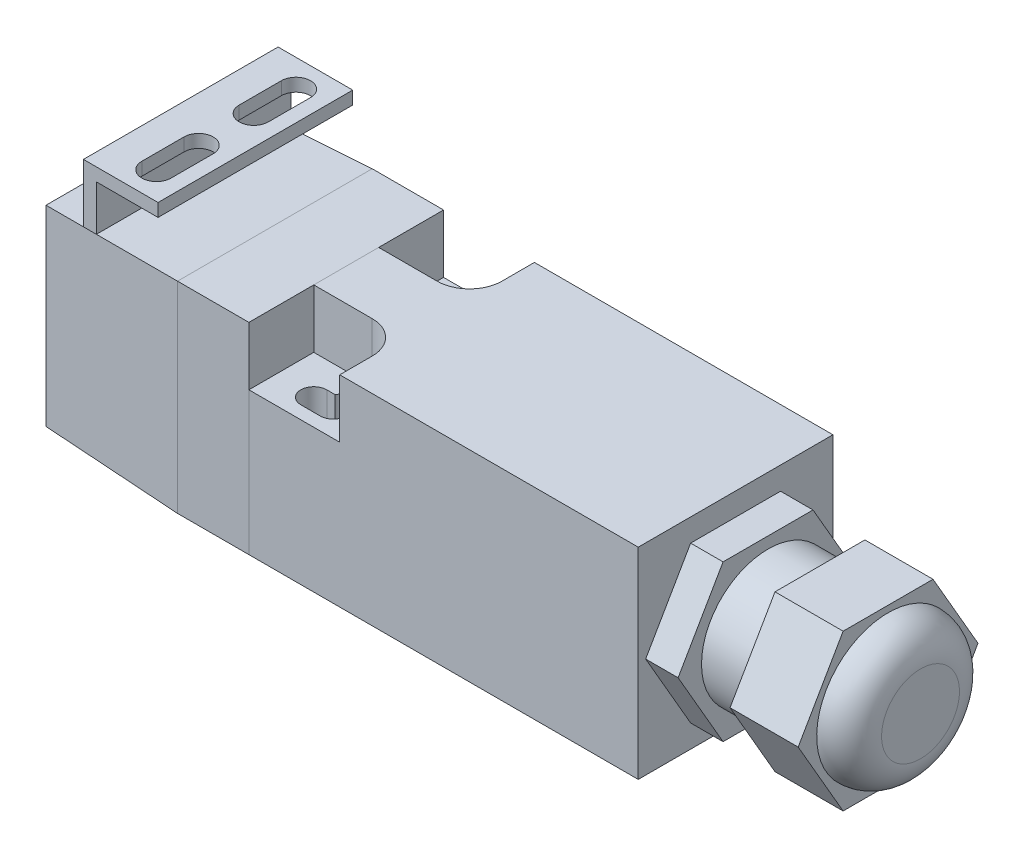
SolidWorks part; units mm, degrees
ref_plane "Plan de face" through (0, 0, 0) normal (0, 0, 1) x (1, 0, 0)
ref_plane "Plan de dessus" through (0, 0, 0) normal (0, 1, 0) x (1, 0, 0)
ref_plane "Plan de droite" through (0, 0, 0) normal (1, 0, 0) x (0, 0, -1)
sketch "Esquisse1" plane through (0, 0, 0) normal (0, 0, 1) x (1, 0, 0)
  line L1 (0, 15.5) -> (60, 15.5)
  line L2 (0, 15.5) -> (0, -15.5)
  line L3 (0, -15.5) -> (60, -15.5)
  line L4 (60, 15.5) -> (60, -15.5)
  dimension "D1" = 31
  dimension "D2" = 60
extrude "Extrusion1" add sketch "Esquisse1" along normal mid plane 30
sketch "Esquisse2" plane through (0, 15.5, 0) normal (0, 1, 0) x (-1, 0, 0)
  line L1 (0, -15) -> (-14, -15)
  line L2 (0, -15) -> (0, -5)
  line L3 (0, -5) -> (-9, -5)
  line L4 (-14, -15) -> (-14, -10)
  line L5 (0, 15) -> (-14, 15)
  line L6 (0, 15) -> (0, 5)
  line L7 (0, 5) -> (-9, 5)
  line L8 (-14, 15) -> (-14, 10)
  arc A0 (-9, -5) -> (-14, -10) centre (-9, -10) ccw
  arc A1 (-9, 5) -> (-14, 10) centre (-9, 10) cw
  point P12 (-14, 5)
  dimension "D4" = 5
  dimension "D1" = 10
  dimension "D2" = 10
  dimension "D3" = 14
extrude "Enlèv. mat.-Extru.1" cut sketch "Esquisse2" against normal blind 9
sketch "Esquisse3" plane through (0, -15.5, 0) normal (0, -1, 0) x (1, 0, 0)
  line L0 (0, 0) -> (31.5871, 0) construction
  line L1 (6, 13) -> (9, 13)
  line L2 (0, 15) -> (0, -15) construction
  line L3 (11, 10) -> (11, 11)
  line L4 (6, 9) -> (7.2679, 9)
  line L9 (6, -9) -> (7.2679, -9)
  line L10 (11, -10) -> (11, -11)
  line L11 (6, -13) -> (9, -13)
  arc A0 (7.2679, 9) -> (11, 10) centre (9, 10) ccw
  arc A1 (6, 13) -> (6, 9) centre (6, 11) ccw
  arc A2 (11, 11) -> (9, 13) centre (9, 11) ccw
  arc A6 (11, -11) -> (9, -13) centre (9, -11) cw
  arc A7 (6, -13) -> (6, -9) centre (6, -11) cw
  arc A8 (7.2679, -9) -> (11, -10) centre (9, -10) cw
  dimension "D1" = 6
  dimension "D2" = 2
  dimension "D7" = 20
  dimension "D3" = 2
  dimension "D4" = 3
  dimension "D5" = 1
  dimension "D6" = 22
extrude "Enlèv. mat.-Extru.2" cut sketch "Esquisse3" against normal through all
sketch "Esquisse4" plane through (0, 0, 0) normal (-1, 0, 0) x (0, 0, 1)
  line L1 (-15, -15.5) -> (15, -15.5)
  line L2 (-15, -15.5) -> (-15, 15.5)
  line L3 (-15, 15.5) -> (15, 15.5)
  line L4 (15, -15.5) -> (15, 15.5)
extrude "Extrusion2" add sketch "Esquisse4" along normal blind 11 separate body
sketch "Esquisse5" plane through (-11, 0, 0) normal (-1, 0, 0) x (0, 0, 1)
  line L1 (-15, 15.5) -> (15, 15.5)
  line L2 (-15, 15.5) -> (-15, -15.5)
  line L3 (-15, -15.5) -> (15, -15.5)
  line L4 (15, 15.5) -> (15, -15.5)
extrude "Extrusion3" add sketch "Esquisse5" along normal blind 21 draft 2
sketch "Esquisse6" plane through (0, 15.5, 0) normal (0, 1, 0) x (-1, 0, 0)
  line L0 (32, 14.2667) -> (32, -14.2667) construction
  line L1 (22, -7.5) -> (27, -7.5)
  line L2 (22, -7.5) -> (22, 7.5)
  line L3 (22, 7.5) -> (27, 7.5)
  line L4 (27, -7.5) -> (27, 7.5)
  dimension "D1" = 5
  dimension "D2" = 15
  dimension "D3" = 5
  dimension "D4" = 7.5
extrude "Enlèv. mat.-Extru.3" cut sketch "Esquisse6" against normal blind 5
sketch "Esquisse7" plane through (0, 15.5, 0) normal (0, 1, 0) x (-1, 0, 0)
  line L0 (32, 14.2667) -> (32, -14.2667) construction
  line L1 (25.5, -6.5) -> (23.5, -6.5)
  line L2 (25.5, -6.5) -> (25.5, 6.5)
  line L3 (25.5, 6.5) -> (23.5, 6.5)
  line L4 (23.5, -6.5) -> (23.5, 6.5)
  dimension "D1" = 2
  dimension "D2" = 13
  dimension "D3" = 6.5
  dimension "D4" = 6.5
extrude "Extrusion4" add sketch "Esquisse7" against normal up to surface (5 mm away) separate body
sketch "Esquisse8" plane through (0, 15.5, 0) normal (0, 1, 0) x (-1, 0, 0)
  line L0 (25.5, -6.5) -> (25.5, 6.5) construction
  line L1 (23.5, 15) -> (25.5, 15)
  line L2 (23.5, 15) -> (23.5, -15)
  line L3 (23.5, -15) -> (25.5, -15)
  line L4 (25.5, 15) -> (25.5, -15)
  line L5 (23.5, 6.5) -> (23.5, -6.5) construction
  dimension "D1" = 30
  dimension "D2" = 15
extrude "Extrusion5" add sketch "Esquisse8" along normal blind 9
sketch "Esquisse9" plane through (-23.5, 0, 0) normal (1, 0, 0) x (0, 0, -1)
  line L0 (15, 24.5) -> (15, 15.5) construction
  line L1 (-15, 24.5) -> (15, 24.5)
  line L2 (-15, 24.5) -> (-15, 22.5)
  line L3 (-15, 22.5) -> (15, 22.5)
  line L4 (15, 24.5) -> (15, 22.5)
  dimension "D1" = 2
extrude "Extrusion6" add sketch "Esquisse9" along normal blind 9.5
sketch "Sketch2" plane through (80.7869, 24.5, -96.1594) normal (0, 1, 0) x (-1, 0, 0)
  line L0 (97.0369, 91.9094) -> (97.0369, 85.4094)
  line L1 (101.5369, 91.9094) -> (101.5369, 85.4094)
  line L2 (99.2869, 85.4094) -> (99.2869, 91.9094) construction
  line L3 (97.0369, 88.6594) -> (101.5369, 88.6594) construction
  line L5 (94.7869, 81.1594) -> (94.7869, 111.1594) construction
  line L6 (94.7869, 81.1594) -> (106.2869, 81.1594) construction
  line L7 (94.7869, 96.1594) -> (110.3072, 96.1594) construction
  arc A0 (101.5369, 91.9094) -> (97.0369, 91.9094) centre (99.2869, 91.9094) ccw
  arc A1 (97.0369, 85.4094) -> (101.5369, 85.4094) centre (99.2869, 85.4094) ccw
  dimension "D1" = 2.25
  dimension "D2" = 11
  dimension "D3" = 4.5
  dimension "D4" = 7.5
extrude "lumiere1" cut sketch "Sketch2" against normal up to next (2 mm away)
pattern_linear "Répétition linéaire1" count 2 spacing 15 along (0, 0, 1) of "lumiere1"
move or copy body "Corps-Déplacer/Copier1" [suppressed] bodies to move or copy 106 112
move or copy body "Corps-Déplacer/Copier2" [suppressed] bodies to move or copy 106 112
sketch "Esquisse10" plane through (60, 0, 0) normal (1, 0, 0) x (0, 0, -1)
  line L1 (13.8564, 0) -> (6.9282, 12)
  line L2 (6.9282, 12) -> (-6.9282, 12)
  line L3 (-6.9282, 12) -> (-13.8564, 0)
  line L4 (-13.8564, 0) -> (-6.9282, -12)
  line L5 (-6.9282, -12) -> (6.9282, -12)
  line L6 (6.9282, -12) -> (13.8564, 0)
  circle A0 centre (0, 0) radius 12 construction
  dimension "D1" = 24
extrude "Extrusion7" add sketch "Esquisse10" along normal blind 5
sketch "Esquisse11" plane through (65, 0, 0) normal (1, 0, 0) x (0, 0, -1)
  circle A0 centre (0, 0) radius 10.25
  dimension "D1" = 20.5
extrude "Extrusion8" add sketch "Esquisse11" along normal blind 8
sketch "Esquisse12" plane through (73, 0, 0) normal (1, 0, 0) x (0, 0, -1)
  line L6 (6.9282, -12) -> (13.8564, 0)
  line L7 (13.8564, 0) -> (6.9282, 12)
  line L8 (6.9282, 12) -> (-6.9282, 12)
  line L9 (-6.9282, 12) -> (-13.8564, 0)
  line L10 (-13.8564, 0) -> (-6.9282, -12)
  line L11 (-6.9282, -12) -> (6.9282, -12)
  line L12 (6.9282, -12) -> (13.8564, 0)
  line L13 (13.8564, 0) -> (6.9282, 12)
  line L14 (6.9282, 12) -> (-6.9282, 12)
  line L15 (-6.9282, 12) -> (-13.8564, 0)
  line L16 (-13.8564, 0) -> (-6.9282, -12)
  line L17 (-6.9282, -12) -> (6.9282, -12)
  dimension "D1" = 0
extrude "Extrusion9" add sketch "Esquisse12" along normal blind 10.5
sketch "Esquisse13" plane through (0, 0, 0) normal (0, 0, 1) x (1, 0, 0)
  line L0 (83.5, 11) -> (83.5, 0)
  line L1 (83.5, 12) -> (83.5, 0) construction
  line L2 (83.5, 0) -> (88.5, 0)
  line L3 (88.5, 0) -> (88.5, 6)
  arc A0 (83.5, 11) -> (88.5, 6) centre (83.5, 6) cw
  dimension "D1" = 5
  dimension "D2" = 6
revolve "Révolution1" add sketch "Esquisse13" angle 360 about L2
